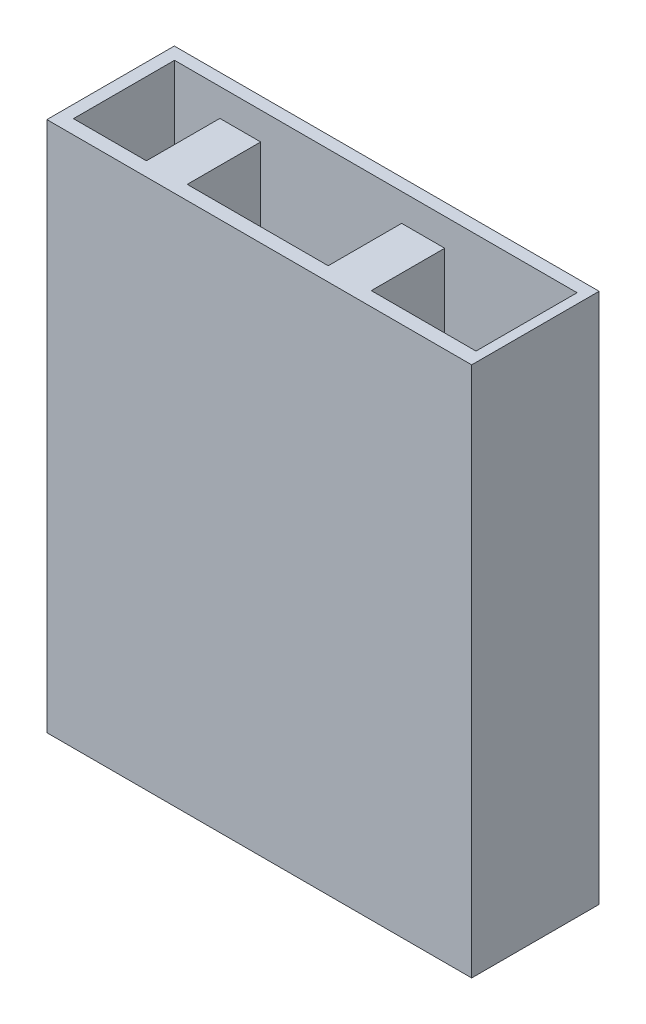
SolidWorks part; units mm, degrees
ref_plane "Front Plane" through (0, 0, 0) normal (0, 0, 1) x (1, 0, 0)
ref_plane "Top Plane" through (0, 0, 0) normal (0, 1, 0) x (1, 0, 0)
ref_plane "Right Plane" through (0, 0, 0) normal (1, 0, 0) x (0, 0, -1)
sketch "Sketch1" plane through (0, 0, 0) normal (0, 1, 0) x (1, 0, 0)
  line L1 (0, 0) -> (4, 0)
  line L2 (0, 0) -> (0, -1.2)
  line L3 (0, -1.2) -> (4, -1.2)
  line L4 (4, 0) -> (4, -1.2)
  dimension "D1" = 4
  dimension "D2" = 1.2
extrude "Boss-Extrude1" add sketch "Sketch1" along normal blind 5
sketch "Sketch2" plane through (0, 5, 0) normal (0, 1, 0) x (1, 0, 0)
  line L0 (1.189, -1.0674) -> (2.5165, -1.0674)
  line L1 (0.1176, -0.1155) -> (3.9081, -0.1155)
  line L2 (0.1176, -0.1155) -> (0.1176, -1.0674)
  line L3 (0.1176, -1.0674) -> (0.8048, -1.0674)
  line L4 (3.9081, -0.1155) -> (3.9081, -1.0674)
  line L5 (0.8048, -0.3759) -> (1.189, -0.3759)
  line L6 (0.8048, -0.3759) -> (0.8048, -1.0674)
  line L7 (2.922, -1.0674) -> (3.9081, -1.0674)
  line L8 (1.189, -0.3759) -> (1.189, -1.0674)
  line L9 (2.5165, -0.3759) -> (2.922, -0.3759)
  line L10 (2.5165, -0.3759) -> (2.5165, -1.0674)
  line L12 (2.922, -0.3759) -> (2.922, -1.0674)
extrude "Cut-Extrude1" cut sketch "Sketch2" against normal through all
